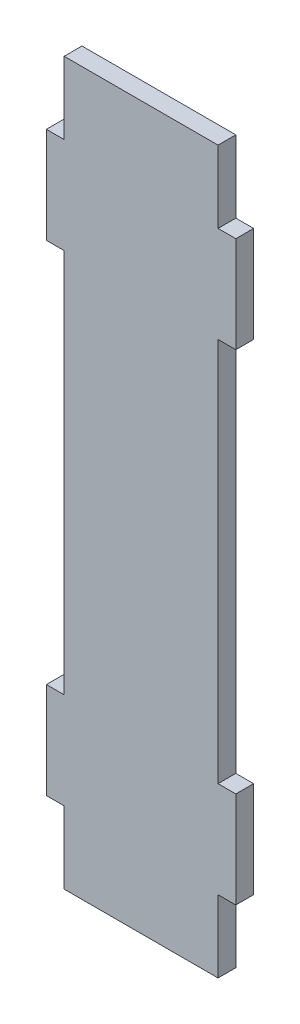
SolidWorks part; units mm, degrees
ref_plane "Front Plane" through (0, 0, 0) normal (0, 0, 1) x (1, 0, 0)
ref_plane "Top Plane" through (0, 0, 0) normal (0, 1, 0) x (1, 0, 0)
ref_plane "Right Plane" through (0, 0, 0) normal (1, 0, 0) x (0, 0, -1)
sketch "Sketch1" plane through (0, 0, 0) normal (0, 0, 1) x (1, 0, 0)
  line L0 (16, 135) -> (19.7, 135)
  line L1 (-16, 150) -> (16, 150)
  line L2 (-16, 150) -> (-16, 135)
  line L3 (-16, 0) -> (16, 0)
  line L4 (16, 150) -> (16, 135)
  line L5 (-19.7, 135) -> (-16, 135)
  line L6 (-19.7, 135) -> (-19.7, 115)
  line L7 (-19.7, 115) -> (-16, 115)
  line L8 (19.7, 135) -> (19.7, 115)
  line L9 (-19.7, 35) -> (-16, 35)
  line L10 (-19.7, 35) -> (-19.7, 15)
  line L11 (-19.7, 15) -> (-16, 15)
  line L12 (19.7, 35) -> (19.7, 15)
  line L13 (16, 115) -> (16, 35)
  line L14 (16, 115) -> (19.7, 115)
  line L15 (-16, 115) -> (-16, 35)
  line L16 (-16, 15) -> (-16, 0)
  line L17 (16, 35) -> (19.7, 35)
  line L18 (16, 15) -> (19.7, 15)
  line L19 (16, 15) -> (16, 0)
  dimension "D1" = 3.7
  dimension "D2" = 20
  dimension "D3" = 15
  dimension "D4" = 32
  dimension "D5" = 150
  dimension "D6" = 39.4
extrude "Boss-Extrude2" add sketch "Sketch1" along normal blind 3.7
